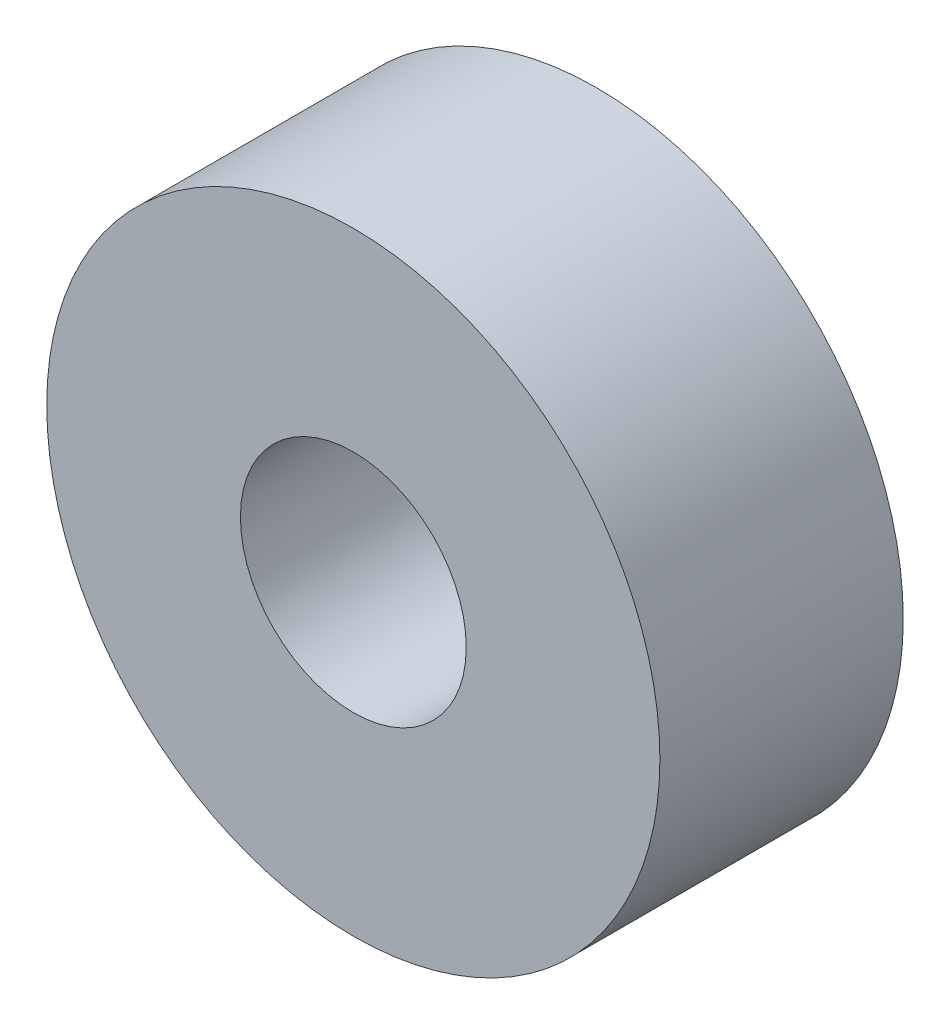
SolidWorks part; units mm, degrees
ref_plane "Front Plane" through (0, 0, 0) normal (0, 0, 1) x (1, 0, 0)
ref_plane "Top Plane" through (0, 0, 0) normal (0, 1, 0) x (1, 0, 0)
ref_plane "Right Plane" through (0, 0, 0) normal (1, 0, 0) x (0, 0, -1)
sketch "Sketch1" plane through (0, 0, 0) normal (0, 0, 1) x (1, 0, 0)
  circle A0 centre (0, 0) radius 4
  circle A1 centre (0, 0) radius 1.4732
  dimension "D1" = 8
  dimension "D2" = 2.9464
extrude "Boss-Extrude1" add sketch "Sketch1" along normal blind 3.175
other "Move Face1" [suppressed] parameters "D1"=0.0762
